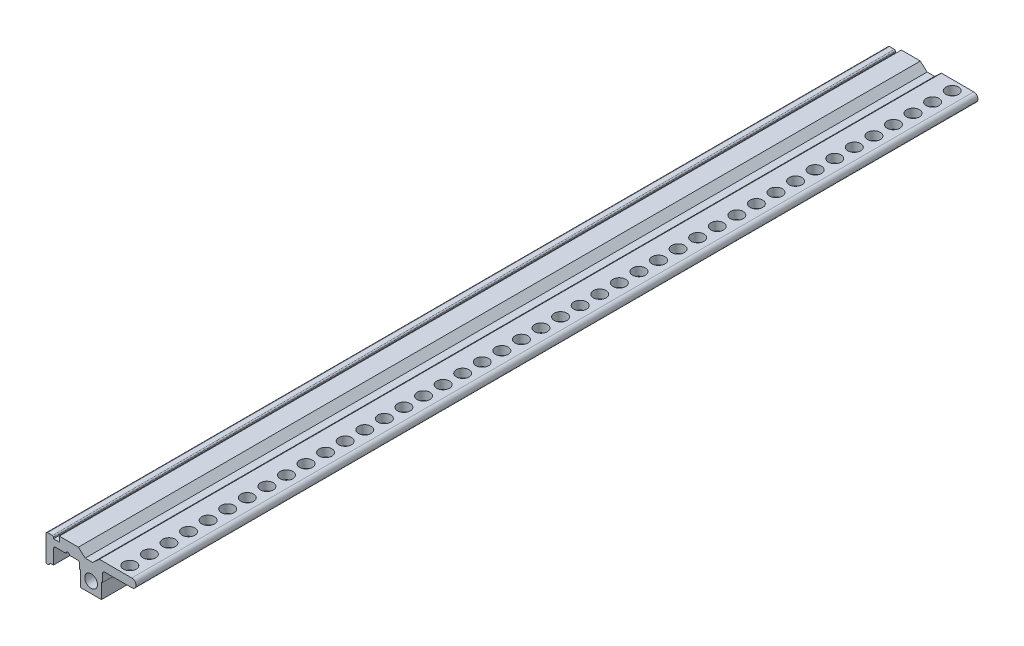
SolidWorks part; units mm, degrees
ref_plane "前视基准面" through (0, 0, 0) normal (0, 0, 1) x (1, 0, 0)
ref_plane "上视基准面" through (0, 0, 0) normal (0, 1, 0) x (1, 0, 0)
ref_plane "右视基准面" through (0, 0, 0) normal (1, 0, 0) x (0, 0, -1)
sketch "草图1" plane through (0, 0, 0) normal (0, 0, 1) x (1, 0, 0)
  line L2 (2426.9819, -3175.6208) -> (2418.5819, -3175.6208)
  line L3 (2418.5819, -3175.6208) -> (2416.8319, -3177.2208)
  line L4 (2416.8319, -3177.2208) -> (2414.8819, -3177.2208)
  line L5 (2414.8819, -3177.2208) -> (2413.1319, -3175.6208)
  line L6 (2413.1319, -3175.6208) -> (2408.1819, -3175.6208)
  line L7 (2408.1819, -3175.6208) -> (2408.1819, -3176.9708)
  line L8 (2408.1819, -3176.9708) -> (2406.6819, -3176.9708)
  line L9 (2406.6819, -3176.9708) -> (2406.6819, -3176.6708)
  line L10 (2406.3819, -3176.3708) -> (2405.1319, -3176.3708)
  line L11 (2404.7319, -3176.7708) -> (2404.7319, -3183.1708)
  line L12 (2405.0319, -3183.4708) -> (2405.2319, -3183.4708)
  line L13 (2406.2711, -3182.8708) -> (2406.6819, -3182.8708)
  line L14 (2406.6819, -3182.8708) -> (2406.6819, -3179.1208)
  line L15 (2407.1819, -3178.6208) -> (2409.8319, -3178.6208)
  line L16 (2410.8319, -3178.6208) -> (2412.9319, -3178.6208)
  line L17 (2413.4319, -3179.1208) -> (2413.4319, -3180.4208)
  line L18 (2413.4319, -3180.4208) -> (2413.7319, -3180.4208)
  line L19 (2413.7319, -3180.4208) -> (2413.7319, -3184.4208)
  line L20 (2413.7319, -3184.4208) -> (2419.1319, -3184.4208)
  line L21 (2419.1319, -3184.4208) -> (2419.1319, -3180.4208)
  line L22 (2419.1319, -3180.4208) -> (2419.4319, -3180.4208)
  line L23 (2419.4319, -3180.4208) -> (2419.4319, -3178.3208)
  line L24 (2419.9319, -3177.8208) -> (2426.9819, -3177.8208)
  circle A0 centre (2416.4319, -3181.5808) radius 1.5
  arc A1 (2406.6819, -3176.6708) -> (2406.3819, -3176.3708) centre (2406.3819, -3176.6708) ccw
  arc A2 (2405.1319, -3176.3708) -> (2404.7319, -3176.7708) centre (2405.1319, -3176.7708) ccw
  arc A3 (2404.7319, -3183.1708) -> (2405.0319, -3183.4708) centre (2405.0319, -3183.1708) ccw
  arc A4 (2405.2319, -3183.4708) -> (2405.4917, -3183.3208) centre (2405.2319, -3183.1708) ccw
  arc A5 (2406.2711, -3182.8708) -> (2405.4917, -3183.3208) centre (2406.2711, -3183.7708) ccw
  arc A6 (2407.1819, -3178.6208) -> (2406.6819, -3179.1208) centre (2407.1819, -3179.1208) ccw
  arc A7 (2410.8319, -3178.6208) -> (2409.8319, -3178.6208) centre (2410.3319, -3178.6208) ccw
  arc A8 (2413.4319, -3179.1208) -> (2412.9319, -3178.6208) centre (2412.9319, -3179.1208) ccw
  arc A9 (2419.9319, -3177.8208) -> (2419.4319, -3178.3208) centre (2419.9319, -3178.3208) ccw
  arc A10 (2426.9819, -3177.8208) -> (2426.9819, -3175.6208) centre (2426.9819, -3176.7208) ccw
  dimension "D1" = 3
extrude "凸台-拉伸1" add sketch "草图1" along normal mid plane 218.44
hole_wizard "M4 螺纹孔1" positions "3D草图1" profile "草图2" tap size "M4" standard "Gb"
sketch3d "3D草图1"
  line L0 (2416.4319, -3181.5808, 109.22) -> (2416.4319, -3181.5808, -109.22) construction
  point P0 (2416.4319, -3181.5808, 109.22)
  point P4 (2416.4319, -3181.5808, -109.22)
sketch "草图2" plane through (2416.4319, -3181.5808, 109.22) normal (1, 0, 0) x (0, -1, 0)
  line L0 (0, 0) -> (0, 15.9914)
  line L1 (0, 15.9914) -> (1.65, 15)
  line L2 (1.65, 15) -> (1.65, 0)
  line L5 (1.65, 0) -> (0, 0)
  line L10 (0, 15.9914) -> (-1.65, 15) construction
  line L11 (0, -6.35) -> (0, 107.95) construction
  dimension "螺纹孔钻头直径" = 3.3
  dimension "螺纹孔钻头深度" = 15
  dimension "导头角度" = 118
sketch "草图3" plane through (0, -3175.6208, 0) normal (0, 1, 0) x (1, 0, 0)
  line L0 (2426.9819, -109.22) -> (2418.5819, -109.22) construction
  line L1 (2428.0819, -109.22) -> (2428.0819, 109.22) construction
  circle A0 centre (2423.9319, -106.68) radius 1.65
  circle A1 centre (2423.9319, -101.6) radius 1.65
  circle A2 centre (2423.9319, -96.52) radius 1.65
  circle A3 centre (2423.9319, -91.44) radius 1.65
  circle A4 centre (2423.9319, -86.36) radius 1.65
  circle A5 centre (2423.9319, -81.28) radius 1.65
  circle A6 centre (2423.9319, -76.2) radius 1.65
  circle A7 centre (2423.9319, -71.12) radius 1.65
  circle A8 centre (2423.9319, -66.04) radius 1.65
  circle A9 centre (2423.9319, -60.96) radius 1.65
  circle A10 centre (2423.9319, -55.88) radius 1.65
  circle A11 centre (2423.9319, -50.8) radius 1.65
  circle A12 centre (2423.9319, -45.72) radius 1.65
  circle A13 centre (2423.9319, -40.64) radius 1.65
  circle A14 centre (2423.9319, -35.56) radius 1.65
  circle A15 centre (2423.9319, -30.48) radius 1.65
  circle A16 centre (2423.9319, -25.4) radius 1.65
  circle A17 centre (2423.9319, -20.32) radius 1.65
  circle A18 centre (2423.9319, -15.24) radius 1.65
  circle A19 centre (2423.9319, -10.16) radius 1.65
  circle A20 centre (2423.9319, -5.08) radius 1.65
  circle A21 centre (2423.9319, 0) radius 1.65
  circle A22 centre (2423.9319, 5.08) radius 1.65
  circle A23 centre (2423.9319, 10.16) radius 1.65
  circle A24 centre (2423.9319, 15.24) radius 1.65
  circle A25 centre (2423.9319, 20.32) radius 1.65
  circle A26 centre (2423.9319, 25.4) radius 1.65
  circle A27 centre (2423.9319, 30.48) radius 1.65
  circle A28 centre (2423.9319, 35.56) radius 1.65
  circle A29 centre (2423.9319, 40.64) radius 1.65
  circle A30 centre (2423.9319, 45.72) radius 1.65
  circle A31 centre (2423.9319, 50.8) radius 1.65
  circle A32 centre (2423.9319, 55.88) radius 1.65
  circle A33 centre (2423.9319, 60.96) radius 1.65
  circle A34 centre (2423.9319, 66.04) radius 1.65
  circle A35 centre (2423.9319, 71.12) radius 1.65
  circle A36 centre (2423.9319, 76.2) radius 1.65
  circle A37 centre (2423.9319, 81.28) radius 1.65
  circle A38 centre (2423.9319, 86.36) radius 1.65
  circle A39 centre (2423.9319, 91.44) radius 1.65
  circle A40 centre (2423.9319, 96.52) radius 1.65
  circle A41 centre (2423.9319, 101.6) radius 1.65
  circle A42 centre (2423.9319, 106.68) radius 1.65
extrude "切除-拉伸1" cut sketch "草图3" against normal blind 431.8
sketch "草图4" plane through (2404.7319, 0, 0) normal (-1, 0, 0) x (0, 0, 1)
  line L0 (-109.22, -3176.7708) -> (-109.22, -3183.1708) construction
  line L1 (109.22, -3175.6208) -> (-109.22, -3175.6208) construction
  circle A0 centre (-104.14, -3180.8708) radius 1
  circle A1 centre (-99.06, -3180.8708) radius 1
  circle A2 centre (-93.98, -3180.8708) radius 1
  circle A3 centre (-88.9, -3180.8708) radius 1
  circle A4 centre (-83.82, -3180.8708) radius 1
  circle A5 centre (-78.74, -3180.8708) radius 1
  circle A6 centre (-73.66, -3180.8708) radius 1
  circle A7 centre (-68.58, -3180.8708) radius 1
  circle A8 centre (-63.5, -3180.8708) radius 1
  circle A9 centre (-58.42, -3180.8708) radius 1
  circle A10 centre (-53.34, -3180.8708) radius 1
  circle A11 centre (-48.26, -3180.8708) radius 1
  circle A12 centre (-43.18, -3180.8708) radius 1
  circle A13 centre (-38.1, -3180.8708) radius 1
  circle A14 centre (-33.02, -3180.8708) radius 1
  circle A15 centre (-27.94, -3180.8708) radius 1
  circle A16 centre (-22.86, -3180.8708) radius 1
  circle A17 centre (-17.78, -3180.8708) radius 1
  circle A18 centre (-12.7, -3180.8708) radius 1
  circle A19 centre (-7.62, -3180.8708) radius 1
  circle A20 centre (-2.54, -3180.8708) radius 1
  circle A21 centre (2.54, -3180.8708) radius 1
  circle A22 centre (7.62, -3180.8708) radius 1
  circle A23 centre (12.7, -3180.8708) radius 1
  circle A24 centre (17.78, -3180.8708) radius 1
  circle A25 centre (22.86, -3180.8708) radius 1
  circle A26 centre (27.94, -3180.8708) radius 1
  circle A27 centre (33.02, -3180.8708) radius 1
  circle A28 centre (38.1, -3180.8708) radius 1
  circle A29 centre (43.18, -3180.8708) radius 1
  circle A30 centre (48.26, -3180.8708) radius 1
  circle A31 centre (53.34, -3180.8708) radius 1
  circle A32 centre (58.42, -3180.8708) radius 1
  circle A33 centre (63.5, -3180.8708) radius 1
  circle A34 centre (68.58, -3180.8708) radius 1
  circle A35 centre (73.66, -3180.8708) radius 1
  circle A36 centre (78.74, -3180.8708) radius 1
  circle A37 centre (83.82, -3180.8708) radius 1
  circle A38 centre (88.9, -3180.8708) radius 1
  circle A39 centre (93.98, -3180.8708) radius 1
  circle A40 centre (99.06, -3180.8708) radius 1
  circle A41 centre (104.14, -3180.8708) radius 1
extrude "切除-拉伸2" cut sketch "草图4" against normal blind 3
hole_wizard "M2.5 螺纹孔1" positions "3D草图2" profile "草图5" tap size "M2.5" standard "Gb"
sketch3d "3D草图2"
  line L0 (2406.6819, -3180.8708, -104.14) -> (2404.7319, -3180.8708, -104.14) construction
  line L1 (2404.7319, -3183.1708, -109.22) -> (2404.7319, -3183.1708, 109.22) construction
  point P0 (2404.7319, -3180.8708, -104.14)
  dimension "D1" = 218.44
sketch "草图5" plane through (2404.7319, -3180.8708, -104.14) normal (0, 1, 0) x (0, 0, 1)
  line L0 (0, 0) -> (0, 6.9659)
  line L1 (0, 6.9659) -> (1.025, 6.35)
  line L2 (1.025, 6.35) -> (1.025, 0)
  line L5 (1.025, 0) -> (0, 0)
  line L10 (0, 6.9659) -> (-1.025, 6.35) construction
  line L11 (0, -6.35) -> (0, 107.95) construction
  dimension "螺纹孔钻头直径" = 2.05
  dimension "螺纹孔钻头深度" = 6.35
  dimension "导头角度" = 118
pattern_linear "阵列(线性)1" count 84 spacing 5.08
equation "\"D4@草图3\"=\"D1@凸台-拉伸1\"/5.08"
equation "\"D4@草图4\"=\"D1@凸台-拉伸1\"/5.08-1"
